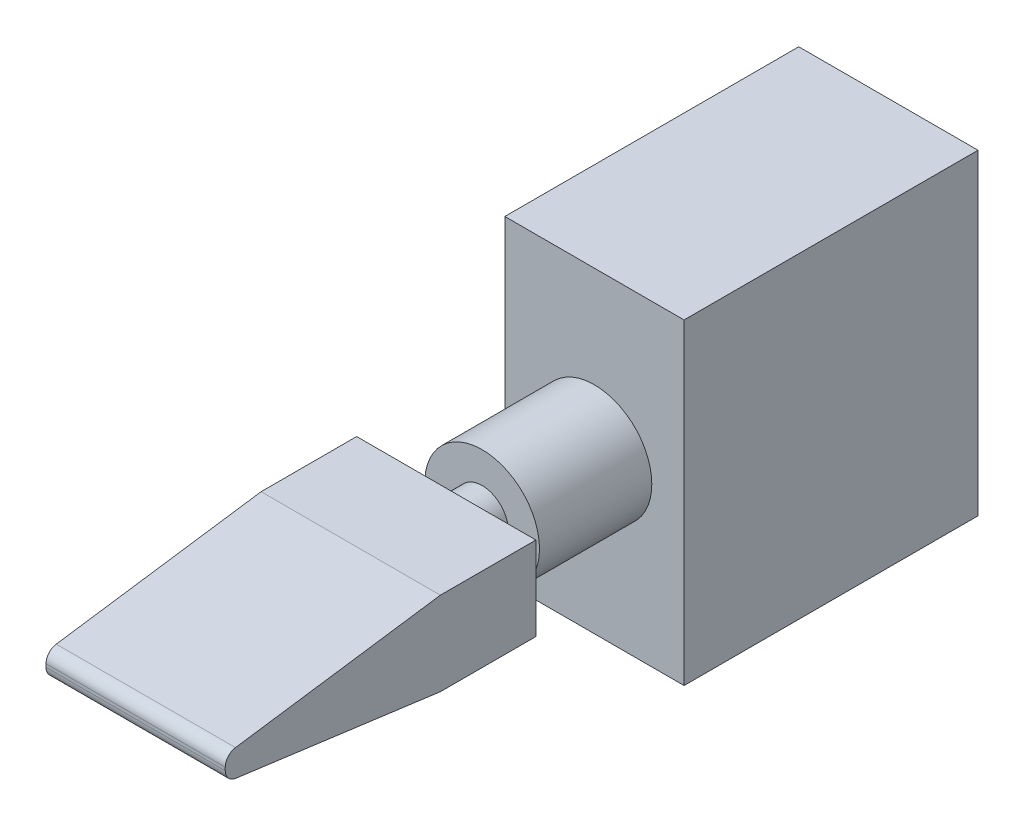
SolidWorks part; units mm, degrees
ref_plane "Front Plane" through (0, 0, 0) normal (0, 0, 1) x (1, 0, 0)
ref_plane "Top Plane" through (0, 0, 0) normal (0, 1, 0) x (1, 0, 0)
ref_plane "Right Plane" through (0, 0, 0) normal (1, 0, 0) x (0, 0, -1)
sketch "Sketch1" plane through (0, 0, 0) normal (0, 0, 1) x (1, 0, 0)
  line L1 (-9.525, -16.8275) -> (9.525, -16.8275)
  line L2 (-9.525, -16.8275) -> (-9.525, 16.8275)
  line L3 (-9.525, 16.8275) -> (9.525, 16.8275)
  line L4 (9.525, -16.8275) -> (9.525, 16.8275)
  line L5 (-9.525, -16.8275) -> (9.525, 16.8275) construction
  line L6 (-9.525, 16.8275) -> (9.525, -16.8275) construction
  point P0 (0, 0)
extrude "Boss-Extrude1" add sketch "Sketch1" along normal blind 31.242
sketch "Sketch2" plane through (0, 0, 31.242) normal (0, 0, 1) x (1, 0, 0)
  circle A0 centre (0, 0) radius 6.096
extrude "Boss-Extrude2" add sketch "Sketch2" along normal blind 11.938
sketch "Sketch3" plane through (0, 0, 43.18) normal (0, 0, 1) x (1, 0, 0)
  circle A0 centre (0, 0) radius 2.794
extrude "Boss-Extrude3" add sketch "Sketch3" along normal blind 3.81
sketch "Sketch4" plane through (0, 0, 46.99) normal (0, 0, 1) x (1, 0, 0)
  line L1 (-9.525, -4.445) -> (9.525, -4.445)
  line L2 (-9.525, -4.445) -> (-9.525, 4.445)
  line L3 (-9.525, 4.445) -> (9.525, 4.445)
  line L4 (9.525, -4.445) -> (9.525, 4.445)
  line L5 (-9.525, -4.445) -> (9.525, 4.445) construction
  line L6 (-9.525, 4.445) -> (9.525, -4.445) construction
  point P0 (0, 0)
extrude "Boss-Extrude4" add sketch "Sketch4" along normal blind 33.02
sketch "Sketch5" plane through (9.525, 0, 0) normal (1, 0, 0) x (0, 0, -1)
  line L0 (-46.99, 4.445) -> (-57.15, 4.445)
  line L1 (-80.01, 4.445) -> (-46.99, 4.445) construction
  line L2 (-80.01, -0.283) -> (-80.01, 0.0453)
  line L3 (-80.01, -4.445) -> (-80.01, 4.445) construction
  line L4 (-57.15, -4.445) -> (-78.908, -1.5419)
  line L5 (-80.01, -4.445) -> (-46.99, -4.445) construction
  line L6 (-78.9214, 1.3023) -> (-57.15, 4.445)
  line L7 (-80.01, -0.1188) -> (-80.01, -4.445)
  line L8 (-80.01, -4.445) -> (-57.15, -4.445)
  line L9 (-57.15, 4.445) -> (-80.01, 4.445)
  line L10 (-80.01, 4.445) -> (-80.01, 0.0453)
  arc A0 (-80.01, -0.283) -> (-78.908, -1.5419) centre (-78.74, -0.283) ccw
  arc A1 (-80.01, 0.0453) -> (-78.9214, 1.3023) centre (-78.74, 0.0453) cw
  point P10 (-80.01, -0.1188)
  point P17 (-80.01, 1.1452)
  dimension "D1" = 1.27
extrude "Cut-Extrude1" cut sketch "Sketch5" against normal blind 33.02 contours A1 L6 M9 M8 | A0 L4 M9 M10
